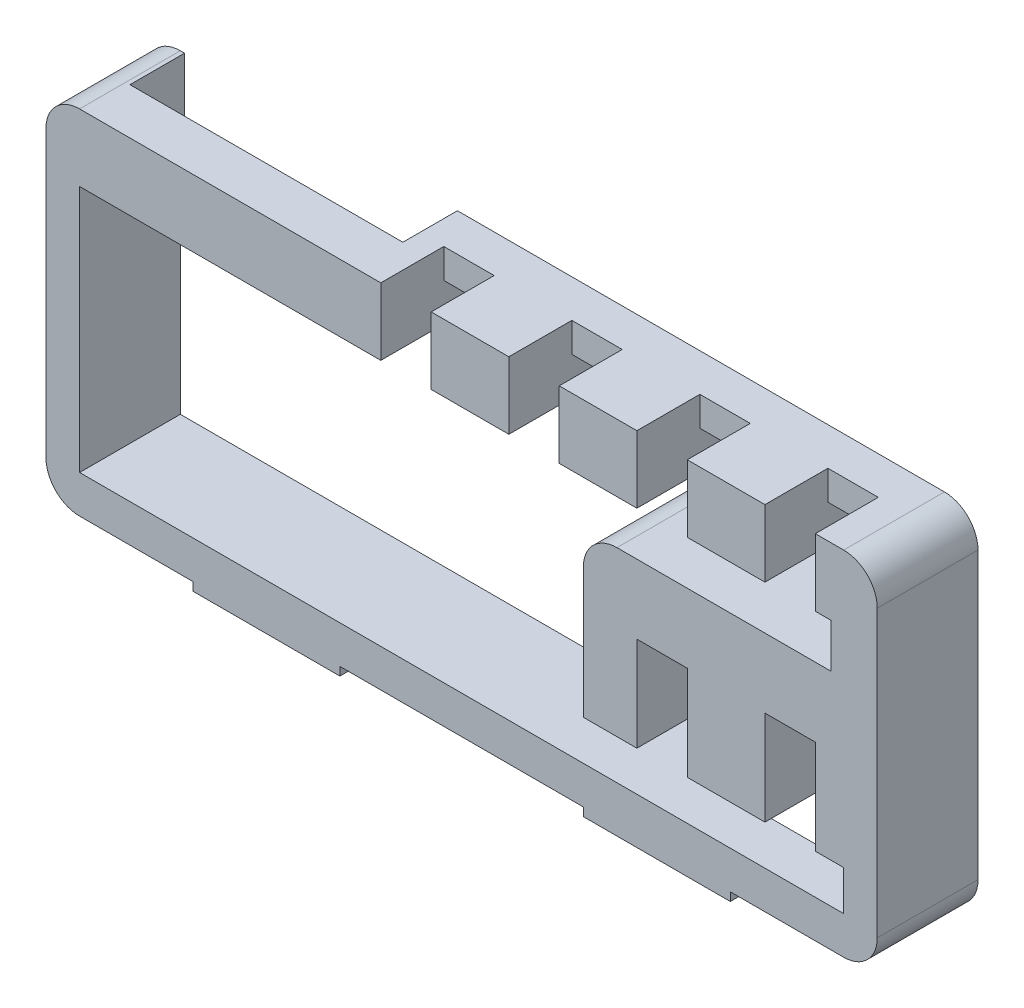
SolidWorks part; units mm, degrees
ref_plane "Front Plane" through (0, 0, 0) normal (0, 0, 1) x (1, 0, 0)
ref_plane "Top Plane" through (0, 0, 0) normal (0, 1, 0) x (1, 0, 0)
ref_plane "Right Plane" through (0, 0, 0) normal (1, 0, 0) x (0, 0, -1)
sketch "Sketch1" plane through (0, 0, 0) normal (0, 0, 1) x (1, 0, 0)
  line L1 (-39.7632, 2.406) -> (-0.1632, 2.406)
  line L2 (-39.7632, 2.406) -> (-39.7632, -14.394)
  line L3 (-39.7632, -14.394) -> (-0.1632, -14.394)
  line L4 (-0.1632, 2.406) -> (-0.1632, -14.394)
  line L5 (-38.1632, -0.794) -> (-1.7632, -0.794)
  line L6 (-38.1632, -0.794) -> (-38.1632, -12.594)
  line L7 (-38.1632, -12.594) -> (-1.7632, -12.594)
  line L8 (-1.7632, -0.794) -> (-1.7632, -12.594)
  dimension "D1" = 3.2
  dimension "D2" = 1.8
  dimension "D3" = 1.6
  dimension "D4" = 1.6
  dimension "D5" = 39.6
  dimension "D6" = 11.8
extrude "Boss-Extrude1" add sketch "Sketch1" along normal blind 4.8
sketch "Sketch2" plane through (0, 0, 0) normal (0, 0, 1) x (1, 0, 0)
  line L0 (-1.7632, -12.594) -> (-1.7632, -0.794) construction
  line L1 (-1.7632, -10.694) -> (-14.1632, -10.694)
  line L2 (-1.7632, -10.694) -> (-1.7632, -7.494)
  line L3 (-1.7632, -7.494) -> (-14.1632, -7.494)
  line L4 (-14.1632, -10.694) -> (-14.1632, -7.494)
  line L6 (-39.7632, -14.394) -> (-0.1632, -14.394) construction
  dimension "D1" = 3.2
  dimension "D2" = 3.7
  dimension "D3" = 12.4
extrude "Boss-Extrude2" add sketch "Sketch2" along normal up to surface (4.8 mm away)
sketch "Sketch3" plane through (0, 0, 0) normal (0, 0, 1) x (1, 0, 0)
  line L1 (-1.7632, -7.494) -> (-14.1632, -7.494)
  line L2 (-1.7632, -7.494) -> (-1.7632, -2.894)
  line L3 (-1.7632, -2.894) -> (-14.1632, -2.894)
  line L4 (-14.1632, -7.494) -> (-14.1632, -2.894)
  dimension "D2" = 4.6
extrude "Boss-Extrude3" add sketch "Sketch3" along normal up to surface (4.8 mm away)
sketch "Sketch4" plane through (0, 0, 0) normal (0, 0, 1) x (1, 0, 0)
  line L0 (-1.7632, -0.794) -> (-38.1632, -0.794) construction
  line L1 (-23.8132, -0.794) -> (-21.4132, -0.794)
  line L2 (-23.8132, -0.794) -> (-23.8132, 1.006)
  line L3 (-23.8132, 1.006) -> (-21.4132, 1.006)
  line L4 (-21.4132, -0.794) -> (-21.4132, 1.006)
  line L5 (-14.1632, -10.694) -> (-1.7632, -10.694) construction
  line L6 (-17.7132, -0.794) -> (-15.3132, -0.794)
  line L7 (-17.7132, -0.794) -> (-17.7132, 1.006)
  line L8 (-17.7132, 1.006) -> (-15.3132, 1.006)
  line L9 (-15.3132, -0.794) -> (-15.3132, 1.006)
  line L10 (-11.6132, -0.794) -> (-9.2132, -0.794)
  line L11 (-11.6132, -0.794) -> (-11.6132, 1.006)
  line L12 (-11.6132, 1.006) -> (-9.2132, 1.006)
  line L13 (-9.2132, -0.794) -> (-9.2132, 1.006)
  line L14 (-5.5132, -0.794) -> (-3.1132, -0.794)
  line L15 (-5.5132, -0.794) -> (-5.5132, 1.006)
  line L16 (-5.5132, 1.006) -> (-3.1132, 1.006)
  line L17 (-3.1132, -0.794) -> (-3.1132, 1.006)
  line L18 (-11.6132, -10.694) -> (-9.2132, -10.694)
  line L19 (-11.6132, -10.694) -> (-11.6132, -8.894)
  line L20 (-11.6132, -8.894) -> (-9.2132, -8.894)
  line L21 (-9.2132, -10.694) -> (-9.2132, -8.894)
  line L23 (-5.5132, -10.694) -> (-3.1132, -10.694)
  line L24 (-5.5132, -10.694) -> (-5.5132, -8.894)
  line L25 (-5.5132, -8.894) -> (-3.1132, -8.894)
  line L26 (-3.1132, -10.694) -> (-3.1132, -8.894)
  line L31 (-0.1632, -14.394) -> (-0.1632, 2.406) construction
  point P30 (-3.1132, -9.794)
  dimension "D1" = 2.4
  dimension "D2" = 2.4
  dimension "D3" = 3.7
  dimension "D4" = 3.7
  dimension "D5" = 2.4
  dimension "D6" = 2.4
  dimension "D7" = 3.7
  dimension "D8" = 1.8
  dimension "D9" = 2.95
  dimension "D10" = 1.8
  dimension "D11" = 2.4
  dimension "D12" = 3.7
  dimension "D13" = 2.4
  dimension "D14" = 2.95
extrude "Cut-Extrude1" cut sketch "Sketch4" along normal up to surface (4.8 mm away)
fillet "Fillet1" radius 1.6 4 edges at (-0.1632, -14.394, 2.4) (-0.1632, 2.406, 2.4) (-39.7632, -14.394, 2.4) (-39.7632, 2.406, 2.4)
ref_plane "Plane1" through (0, -14.394, 0) normal (0, -1, 0) x (-1, 0, 0)
sketch "Sketch5" plane through (0, -14.394, 0) normal (0, -1, 0) x (-1, 0, 0)
  line L0 (38.1632, 0) -> (1.7632, 0) construction
  line L1 (9.9632, 0) -> (1.9632, 0)
  line L2 (9.9632, 0) -> (9.9632, -2.6)
  line L3 (9.9632, -2.6) -> (1.9632, -2.6)
  line L4 (1.9632, 0) -> (1.9632, -2.6)
  line L5 (38.1632, -4.8) -> (1.7632, -4.8) construction
  line L6 (1.7632, 0) -> (1.7632, -4.8) construction
  dimension "D1" = 8
  dimension "D2" = 2.2
  dimension "D3" = 0.2
extrude "Cut-Extrude2" cut sketch "Sketch5" against normal up to surface (1.8 mm away)
ref_plane "Plane2" through (0, 2.406, 0) normal (0, 1, 0) x (1, 0, 0)
sketch "Sketch6" plane through (0, 2.406, 0) normal (0, 1, 0) x (1, 0, 0)
  line L0 (-1.7632, 0) -> (-38.1632, 0) construction
  line L1 (-24.9632, 0) -> (-37.9632, 0)
  line L2 (-24.9632, 0) -> (-24.9632, -2.6)
  line L3 (-24.9632, -2.6) -> (-37.9632, -2.6)
  line L4 (-37.9632, 0) -> (-37.9632, -2.6)
  line L6 (-38.1632, 0) -> (-38.1632, -4.8) construction
  line L7 (-1.7632, -4.8) -> (-38.1632, -4.8) construction
  dimension "D1" = 0.2
  dimension "D2" = 2.2
  dimension "D3" = 13
extrude "Cut-Extrude3" cut sketch "Sketch6" against normal up to surface (3.2 mm away)
ref_plane "Plane3" through (0, 2.406, 0) normal (0, 1, 0) x (1, 0, 0)
sketch "Sketch7" plane through (0, 2.406, 0) normal (0, 1, 0) x (1, 0, 0)
  line L0 (-1.7632, -4.8) -> (-38.1632, -4.8) construction
  line L1 (-23.8132, -4.8) -> (-21.4132, -4.8)
  line L2 (-23.8132, -4.8) -> (-23.8132, -1.8)
  line L3 (-23.8132, -1.8) -> (-21.4132, -1.8)
  line L4 (-21.4132, -4.8) -> (-21.4132, -1.8)
  line L6 (-17.7132, -4.8) -> (-15.3132, -4.8)
  line L7 (-17.7132, -4.8) -> (-17.7132, -1.8)
  line L8 (-17.7132, -1.8) -> (-15.3132, -1.8)
  line L9 (-15.3132, -4.8) -> (-15.3132, -1.8)
  line L10 (-11.6132, -4.8) -> (-9.2132, -4.8)
  line L11 (-11.6132, -4.8) -> (-11.6132, -1.8)
  line L12 (-11.6132, -1.8) -> (-9.2132, -1.8)
  line L13 (-9.2132, -4.8) -> (-9.2132, -1.8)
  line L14 (-5.5132, -4.8) -> (-3.1132, -4.8)
  line L15 (-5.5132, -4.8) -> (-5.5132, -1.8)
  line L16 (-5.5132, -1.8) -> (-3.1132, -1.8)
  line L17 (-3.1132, -4.8) -> (-3.1132, -1.8)
  line L22 (-1.7632, -4.8) -> (-1.7632, 0) construction
  dimension "D1" = 2.4
  dimension "D2" = 2.4
  dimension "D3" = 2.4
  dimension "D4" = 2.4
  dimension "D5" = 3.7
  dimension "D6" = 3.7
  dimension "D7" = 3.7
  dimension "D8" = 3
  dimension "D9" = 3
  dimension "D10" = 3
  dimension "D11" = 3
  dimension "D12" = 1.35
extrude "Cut-Extrude4" cut sketch "Sketch7" against normal blind 3
sketch "Sketch8" plane through (0, 0, 0) normal (0, 0, 1) x (1, 0, 0)
  line L0 (-9.2132, -8.894) -> (-11.6132, -8.894) construction
  line L1 (-11.6132, -8.894) -> (-9.2132, -8.894)
  line L2 (-11.6132, -8.894) -> (-11.6132, -6.194)
  line L3 (-11.6132, -6.194) -> (-9.2132, -6.194)
  line L4 (-9.2132, -8.894) -> (-9.2132, -6.194)
  line L6 (-5.5132, -8.894) -> (-3.1132, -8.894)
  line L7 (-5.5132, -8.894) -> (-5.5132, -6.194)
  line L8 (-5.5132, -6.194) -> (-3.1132, -6.194)
  line L9 (-3.1132, -8.894) -> (-3.1132, -6.194)
  dimension "D1" = 2.7
  dimension "D2" = 2.7
extrude "Cut-Extrude5" cut sketch "Sketch8" along normal blind 5
fillet "Fillet2" radius 1.6 1 edges at (-14.1632, -2.894, 2.4)
sketch "Sketch10" plane through (0, 0, 0) normal (0, 0, 1) x (1, 0, 0)
  line L0 (-38.1632, -14.394) -> (-1.7632, -14.394) construction
  line L1 (-7.1632, -14.394) -> (-14.1632, -14.394)
  line L2 (-7.1632, -14.394) -> (-7.1632, -14.794)
  line L3 (-7.1632, -14.794) -> (-14.1632, -14.794)
  line L4 (-14.1632, -14.394) -> (-14.1632, -14.794)
  line L5 (-0.1632, -12.794) -> (-0.1632, 0.806) construction
  line L6 (-25.7632, -14.394) -> (-32.7632, -14.394)
  line L7 (-25.7632, -14.394) -> (-25.7632, -14.794)
  line L8 (-25.7632, -14.794) -> (-32.7632, -14.794)
  line L9 (-32.7632, -14.394) -> (-32.7632, -14.794)
  line L10 (-39.7632, 0.806) -> (-39.7632, -12.794) construction
  point P12 (-7.1632, -14.594)
  dimension "D1" = 0.4
  dimension "D2" = 0.4
  dimension "D3" = 7
  dimension "D4" = 7
  dimension "D5" = 7
  dimension "D6" = 7
extrude "Boss-Extrude5" add sketch "Sketch10" along normal up to surface (4.8 mm away)
sketch "Sketch11" plane through (0, 0, 0) normal (0, 0, 1) x (1, 0, 0)
  line L0 (-1.7632, -0.794) -> (-3.1132, -0.794) construction
  line L1 (-1.7632, -2.894) -> (-2.3632, -2.894)
  line L2 (-1.7632, -2.894) -> (-1.7632, -0.794)
  line L3 (-1.7632, -0.794) -> (-2.3632, -0.794)
  line L4 (-2.3632, -2.894) -> (-2.3632, -0.794)
  dimension "D1" = 0.6
extrude "Boss-Extrude6" add sketch "Sketch11" along normal up to surface (4.8 mm away)
sketch "Sketch12" plane through (0, 0, 0) normal (0, 0, 1) x (1, 0, 0)
  line L1 (-7.1632, -14.794) -> (-9.9632, -14.794)
  line L2 (-7.1632, -14.794) -> (-7.1632, -14.394)
  line L3 (-7.1632, -14.394) -> (-9.9632, -14.394)
  line L4 (-9.9632, -14.794) -> (-9.9632, -14.394)
extrude "Cut-Extrude6" cut sketch "Sketch12" along normal up to surface (2.6 mm away)
